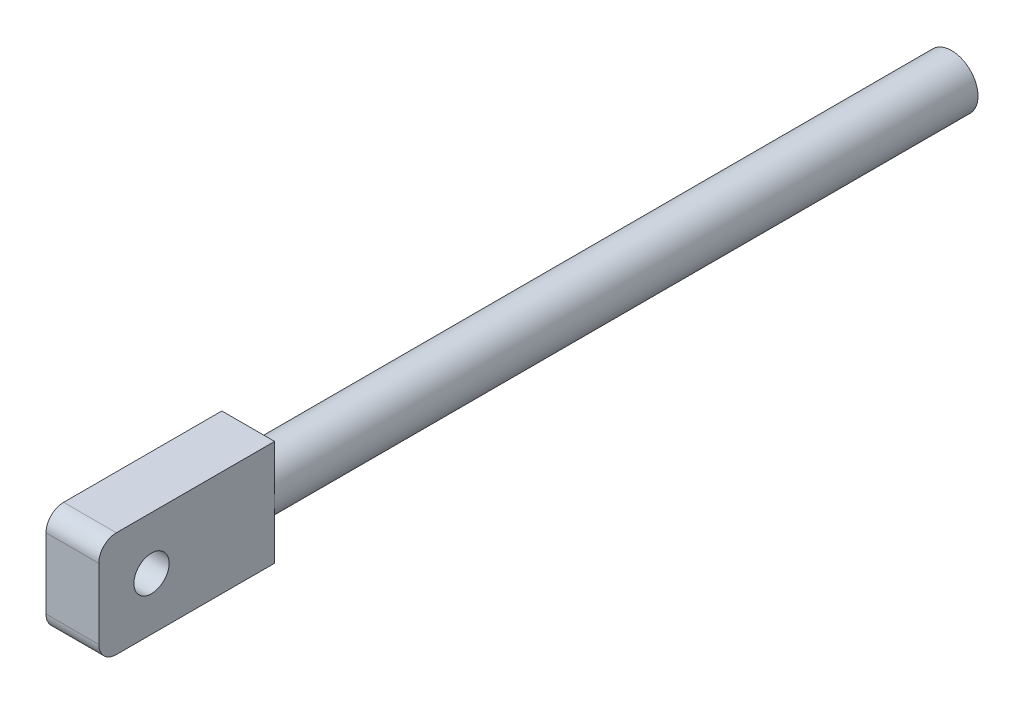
SolidWorks part; units mm, degrees
ref_plane "Front Plane" through (0, 0, 0) normal (0, 0, 1) x (1, 0, 0)
ref_plane "Top Plane" through (0, 0, 0) normal (0, 1, 0) x (1, 0, 0)
ref_plane "Right Plane" through (0, 0, 0) normal (1, 0, 0) x (0, 0, -1)
sketch "Sketch2" plane through (0, 0, 0) normal (0, 0, 1) x (1, 0, 0)
  circle A0 centre (0, 0) radius 15
  dimension "D1" = 30
extrude "Boss-Extrude1" add sketch "Sketch2" along normal blind 400
sketch "Sketch3" plane through (0, 0, 400) normal (0, 0, 1) x (1, 0, 0)
  line L1 (-15, 30) -> (15, 30)
  line L2 (-15, 30) -> (-15, -30)
  line L3 (-15, -30) -> (15, -30)
  line L4 (15, 30) -> (15, -30)
  dimension "D2" = 30
  dimension "D3" = 60
extrude "Boss-Extrude2" add sketch "Sketch3" along normal blind 100
fillet "Fillet1" radius 10 2 edges at (0, -30, 500) (0, 30, 500)
sketch "Sketch4" plane through (15, 0, 0) normal (1, 0, 0) x (0, 0, -1)
  line L0 (-500, 0) -> (-470, 0) construction
  line L1 (-500, -20) -> (-500, 20) construction
  circle A0 centre (-470, 0) radius 10
  dimension "D1" = 20
  dimension "D2" = 30
extrude "Cut-Extrude1" cut sketch "Sketch4" against normal blind 100
